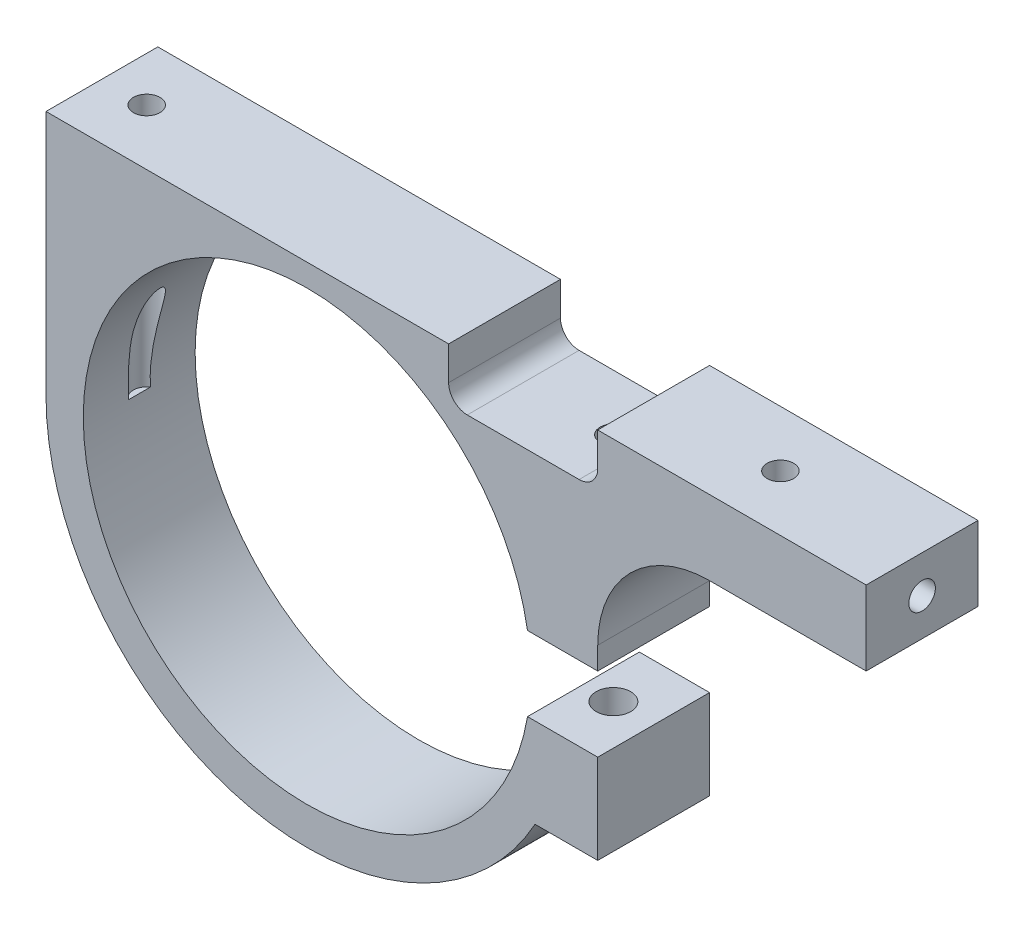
SolidWorks part; units mm, degrees
ref_plane "Front Plane" through (0, 0, 0) normal (0, 0, 1) x (1, 0, 0)
ref_plane "Top Plane" through (0, 0, 0) normal (0, 1, 0) x (1, 0, 0)
ref_plane "Right Plane" through (0, 0, 0) normal (1, 0, 0) x (0, 0, -1)
sketch "Sketch1" plane through (0, 0, 0) normal (0, 0, 1) x (1, 0, 0)
  line L0 (34.29, 14.605) -> (47.625, 14.605)
  line L1 (-22.225, 20.955) -> (12.065, 20.955)
  line L2 (-22.225, 20.955) -> (-22.225, 0)
  line L4 (47.625, 20.955) -> (47.625, 14.605)
  line L6 (24.765, 20.955) -> (47.625, 20.955)
  line L9 (24.765, -3.175) -> (18.7836, -3.175)
  line L11 (12.065, 20.955) -> (12.065, 18.0975)
  line L12 (13.6525, 16.51) -> (23.1775, 16.51)
  line L13 (24.765, 20.955) -> (24.765, 18.0975)
  line L15 (24.765, -10.795) -> (24.765, -3.175)
  line L16 (24.765, 5.08) -> (24.765, 3.175)
  line L17 (24.765, 3.175) -> (18.7836, 3.175)
  line L18 (18.7836, 3.175) -> (18.7836, -3.175) construction
  line L19 (18.7836, 0) -> (0, 0) construction
  line L20 (24.765, -10.795) -> (19.4273, -10.795)
  arc A0 (18.7836, 3.175) -> (18.7836, -3.175) centre (0, 0) ccw
  arc A1 (-22.225, 0) -> (19.4273, -10.795) centre (0, 0) ccw
  arc A4 (24.765, 5.08) -> (34.29, 14.605) centre (34.29, 5.08) cw
  arc A5 (23.1775, 16.51) -> (24.765, 18.0975) centre (23.1775, 18.0975) ccw
  arc A6 (12.065, 18.0975) -> (13.6525, 16.51) centre (13.6525, 18.0975) ccw
  point P22 (24.765, 16.51)
  point P25 (12.065, 16.51)
  dimension "D1" = 38.1
  dimension "D2" = 44.45
  dimension "D6" = 20.955
  dimension "D7" = 6.35
  dimension "D10" = 34.29
  dimension "D13" = 1.5875
  dimension "D9" = 9.525
  dimension "D3" = 69.85
  dimension "D4" = 6.35
  dimension "D11" = 12.7
  dimension "D12" = 4.445
  dimension "D14" = 31.75
extrude "Boss-Extrude1" add sketch "Sketch1" along normal mid plane 9.525
sketch "Sketch2" plane through (0, 20.955, 0) normal (0, 1, 0) x (1, 0, 0)
  line L0 (0, 0) -> (-18.415, 0) construction
  line L1 (0, 0) -> (35.56, 0) construction
  line L2 (-22.225, -4.7625) -> (-22.225, 4.7625) construction
  circle A0 centre (-18.415, 0) radius 1.1303
  circle A1 centre (35.56, 0) radius 1.1303
  circle A2 centre (21.336, 0) radius 1.1303
  dimension "D1" = 2.2606
  dimension "D2" = 53.975
  dimension "D4" = 43.561
  dimension "D3" = 3.81
extrude "Cut-Extrude1" cut sketch "Sketch2" against normal blind 21.59
sketch "Sketch3" plane through (0, 20.955, 0) normal (0, 1, 0) x (1, 0, 0)
  circle A0 centre (21.336, 0) radius 1.1303
  dimension "D1" = 2.2606
extrude "Cut-Extrude2" cut sketch "Sketch3" against normal through all
sketch "Sketch4" plane through (0, -10.795, 0) normal (0, -1, 0) x (1, 0, 0)
  circle A0 centre (21.336, 0) radius 1.4732
  dimension "D1" = 2.9464
extrude "Cut-Extrude3" cut sketch "Sketch4" against normal up to next
sketch "Sketch5" plane through (47.625, 0, 0) normal (1, 0, 0) x (0, 0, -1)
  line L0 (-4.7625, 20.955) -> (4.7625, 14.605) construction
  circle A0 centre (0, 17.78) radius 1.1303
  dimension "D1" = 2.2606
extrude "Cut-Extrude4" cut sketch "Sketch5" against normal blind 12.7
sketch "Sketch6" plane through (0, -10.795, 0) normal (0, -1, 0) x (1, 0, 0)
  circle A0 centre (21.336, 0) radius 3.175
  dimension "D1" = 6.35
extrude "Cut-Extrude5" cut sketch "Sketch6" along normal through all
